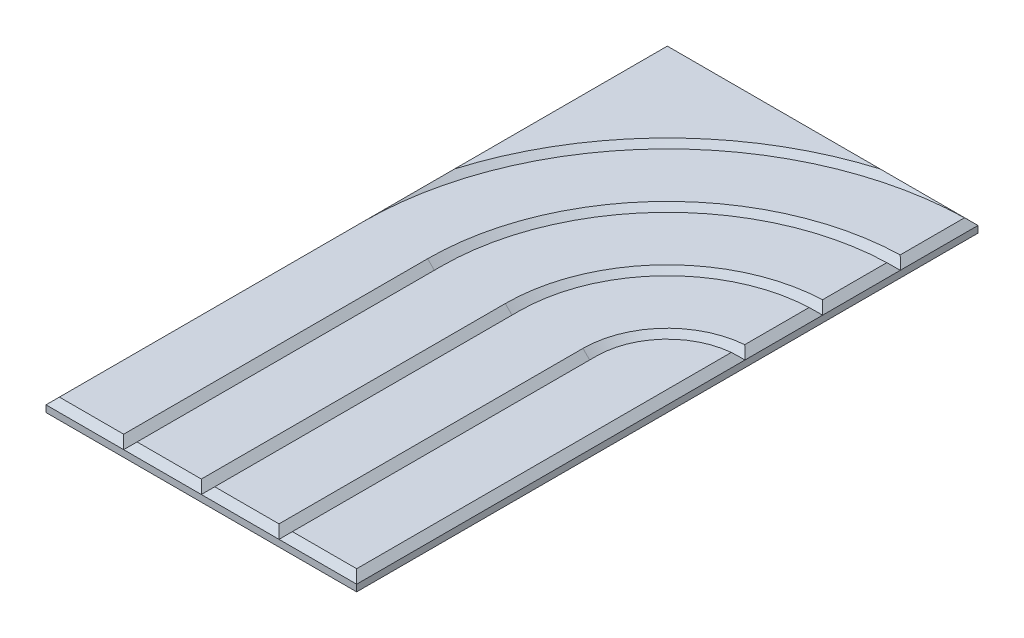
SolidWorks part; units mm, degrees
ref_plane "Front Plane" through (0, 0, 0) normal (0, 0, 1) x (1, 0, 0)
ref_plane "Top Plane" through (0, 0, 0) normal (0, 1, 0) x (1, 0, 0)
ref_plane "Right Plane" through (0, 0, 0) normal (1, 0, 0) x (0, 0, -1)
sketch "Sketch1" plane through (0, 0, 0) normal (0, 1, 0) x (1, 0, 0)
  line L1 (-290, -580) -> (290, -580)
  line L2 (-290, -580) -> (-290, 580)
  line L3 (-290, 580) -> (290, 580)
  line L4 (290, -580) -> (290, 580)
  line L5 (-290, -580) -> (290, 580) construction
  line L6 (-290, 580) -> (290, -580) construction
  point P0 (0, 0)
  dimension "D1" = 580
  dimension "D2" = 1160
extrude "Boss-Extrude1" add sketch "Sketch1" along normal blind 25
sketch "Sketch2" plane through (0, 25, 0) normal (0, 1, 0) x (1, 0, 0)
  line L0 (-290, -580) -> (-290, 0)
  line L1 (-290, 580) -> (-290, -580) construction
  line L2 (290, 580) -> (-290, 580) construction
  line L3 (-145, -580) -> (-145, 0)
  line L4 (0, -580) -> (0, 0)
  line L5 (145, -580) -> (145, 0)
  arc A0 (-290, 0) -> (290, 580) centre (290, 0) cw
  arc A1 (-145, 0) -> (290, 435) centre (290, 0) cw
  arc A2 (0, 0) -> (290, 290) centre (290, 0) cw
  arc A3 (145, 0) -> (290, 145) centre (290, 0) cw
  dimension "D1" = 145
  dimension "D2" = 145
  dimension "D3" = 145
sketch "Sketch3" plane through (0, 0, 580) normal (0, 0, 1) x (1, 0, 0)
  line L0 (-277.5, 25) -> (-290, 12.5)
  line L1 (290, 25) -> (-290, 25) construction
  line L2 (-290, 25) -> (-290, 0) construction
  line L3 (-290, 12.5) -> (-302.5, 25)
  line L4 (-302.5, 25) -> (-277.5, 25)
  line L5 (-132.5, 25) -> (-145, 12.5)
  line L6 (-145, 12.5) -> (-157.5, 25)
  line L7 (-157.5, 25) -> (-132.5, 25)
  line L8 (12.5, 25) -> (0, 12.5)
  line L9 (0, 12.5) -> (-12.5, 25)
  line L10 (-12.5, 25) -> (12.5, 25)
  line L11 (157.5, 25) -> (145, 12.5)
  line L12 (145, 12.5) -> (132.5, 25)
  line L13 (132.5, 25) -> (157.5, 25)
  dimension "D1" = 4
sweep "Cut-Sweep1" cut profiles "Sketch3" path "Sketch2"
chamfer "Chamfer1" distance 12.5 angle 45 10 edges at (290, 25, 223.75) (223.75, 25, 580) (72.5, 25, 580) (-72.5, 25, 580) (-217.5, 25, 580) (-290, 25, -350.5315) (-60.5315, 25, -580) (290, 25, -507.5) (290, 25, -362.5) (290, 25, -217.5)
